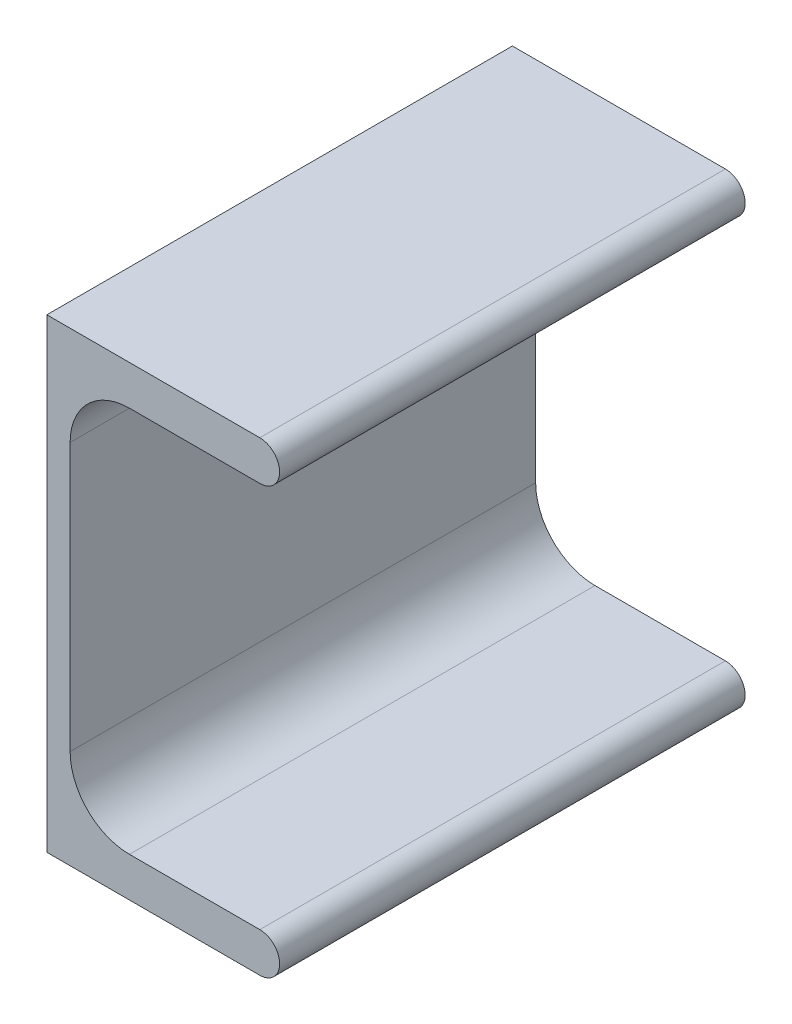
SolidWorks part; units mm, degrees
ref_plane "Front" through (0, 0, 0) normal (0, 0, 1) x (1, 0, 0)
ref_plane "Top" through (0, 0, 0) normal (0, 1, 0) x (1, 0, 0)
ref_plane "Right" through (0, 0, 0) normal (1, 0, 0) x (0, 0, -1)
sketch "Sketch1" plane through (0, 0, 0) normal (0, 0, 1) x (1, 0, 0)
  line L0 (45.75, 50) -> (0, 50)
  line L1 (45.75, -50) -> (0, -50)
  line L2 (0, 50) -> (0, -50)
  line L6 (5, 28.75) -> (5, -28.75)
  line L7 (17.75, 41.5) -> (45.75, 41.5)
  line L8 (17.75, -41.5) -> (45.75, -41.5)
  arc A0 (5, -28.75) -> (17.75, -41.5) centre (17.75, -28.75) ccw
  arc A1 (5, 28.75) -> (17.75, 41.5) centre (17.75, 28.75) cw
  arc A2 (45.75, 41.5) -> (45.75, 50) centre (45.75, 45.75) ccw
  arc A5 (45.75, -50) -> (45.75, -41.5) centre (45.75, -45.75) ccw
  point P10 (50, -45.75)
  point P14 (0, 0)
  dimension "D1" = 12.75
  dimension "Height" = 100
  dimension "Thickness" = 5
  dimension "Flange" = 8.5
  dimension "Width" = 50
extrude "Extrude1" add sketch "Sketch1" along normal mid plane 100
equation "\"D1@Sketch1\" = \"Flange@Sketch1\"*1.5"
